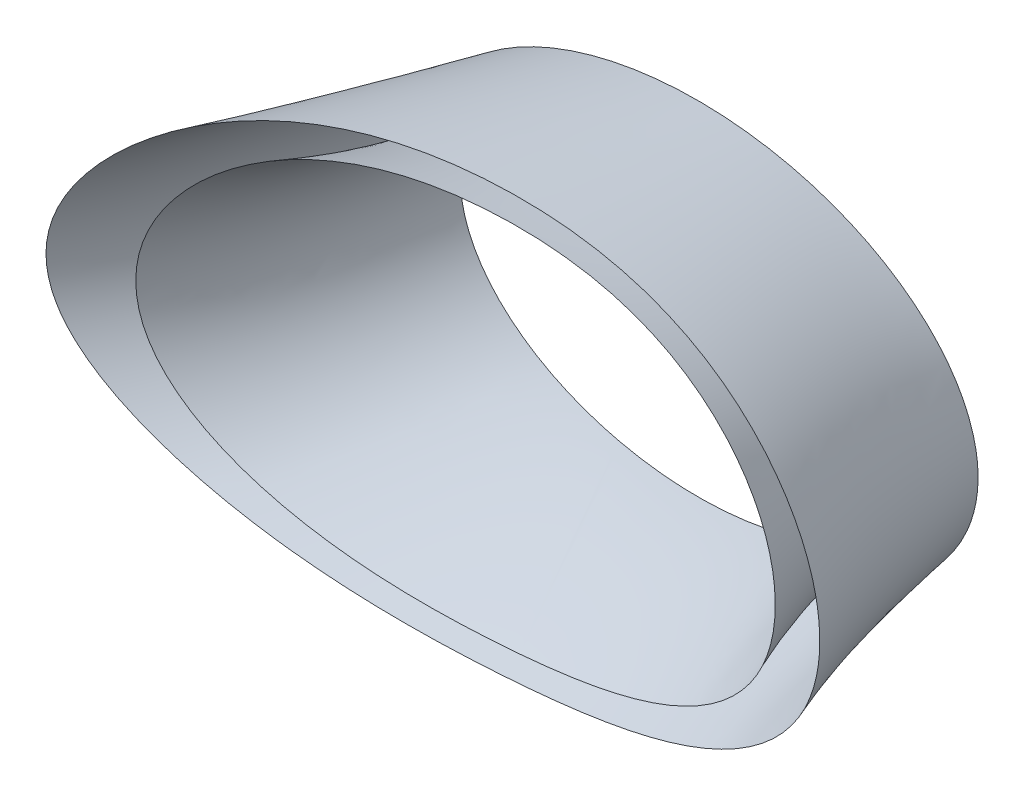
SolidWorks part; units mm, degrees
ref_plane "Ebene vorne" through (0, 0, 0) normal (0, 0, 1) x (1, 0, 0)
ref_plane "Ebene oben" through (0, 0, 0) normal (0, 1, 0) x (1, 0, 0)
ref_plane "Ebene rechts" through (0, 0, 0) normal (1, 0, 0) x (0, 0, -1)
sketch "Skizze1" plane through (0, 0, 0) normal (0, 0, 1) x (1, 0, 0)
  ellipse E0 centre (0, 0) end of major axis (50, 0) minor radius 33
  dimension "D1" = 100
  dimension "D2" = 66
sketch "Skizze7" plane through (0, 0, 0) normal (0, 0, 1) x (1, 0, 0)
  ellipse E0 centre (0, 0) end of major axis (58.8535, 0) minor radius 39.1697
sketch3d "3D-Skizze4"
  spline S1 degree 3 number of poles 112 (-46.2977, 28.391, 47.9602) -> (-46.2977, 28.391, 47.9602)
sketch3d "3D-Skizze7"
  spline S1 degree 3 number of poles 73 (-79.8588, 0, 57.2539) -> (-79.8588, 0, 57.2539)
surface "Oberfläche-Ausformung1"
surface "Oberfläche-Ausformung2"
